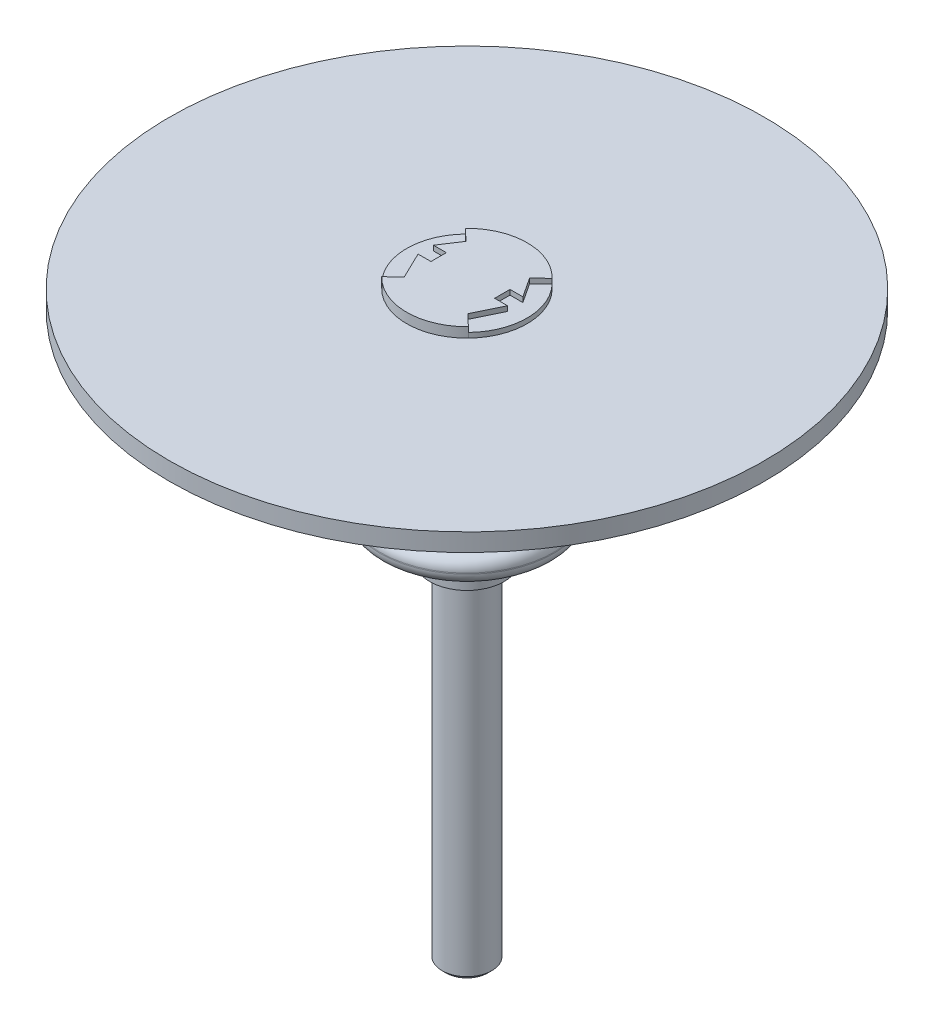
SolidWorks part; units mm, degrees
other "Camera1"
other "Camera2"
ref_plane "Front Plane" through (0, 0, 0) normal (0, 0, 1) x (1, 0, 0)
ref_plane "Top Plane" through (0, 0, 0) normal (0, 1, 0) x (1, 0, 0)
ref_plane "Right Plane" through (0, 0, 0) normal (1, 0, 0) x (0, 0, -1)
sketch "Sketch1" plane through (0, 0, 0) normal (0, 1, 0) x (1, 0, 0)
  circle A0 centre (0, 0) radius 1.5875
  dimension "D1" = 3.175
extrude "Boss-Extrude1" add sketch "Sketch1" along normal blind 22.225
chamfer "Chamfer1" distance 0.254 angle 45 1 edges at (0, 0, 1.5875)
sketch "Sketch2" plane through (0, 22.225, 0) normal (0, 1, 0) x (1, 0, 0)
  circle A0 centre (0, 0) radius 2.3813
  dimension "D1" = 4.7625
extrude "Boss-Extrude2" add sketch "Sketch2" along normal blind 2.3813 separate body
sketch "Sketch3" plane through (0, 24.6062, 0) normal (0, 1, 0) x (1, 0, 0)
  circle A0 centre (0, 0) radius 5.5562
  dimension "D1" = 11.1125
extrude "Boss-Extrude3" add sketch "Sketch3" along normal blind 1.5875 separate body
sketch "Sketch4" plane through (0, 26.1937, 0) normal (0, 1, 0) x (1, 0, 0)
  circle A0 centre (0, 0) radius 4.3656
  dimension "D1" = 8.7312
extrude "Boss-Extrude4" add sketch "Sketch4" along normal blind 9.1281
fillet "Fillet1" radius 0.762 2 edges at (0, 24.6062, 5.5562) (0, 26.1937, 5.5562)
fillet "Fillet2" radius 0.254 1 edges at (0, 26.1937, 4.3656)
chamfer "Chamfer2" distance 0.508 angle 45 1 edges at (0, 35.3219, 4.3656)
sketch "Sketch5" plane through (0, 35.3219, 0) normal (0, 1, 0) x (1, 0, 0)
  circle A0 centre (0, 0) radius 3.8576
extrude "Boss-Extrude5" add sketch "Sketch5" along normal blind 0.7937
sketch "Sketch6" plane through (0, 36.1156, 0) normal (0, 1, 0) x (1, 0, 0)
  circle A0 centre (0, 0) radius 19.05
  dimension "D1" = 38.1
extrude "Boss-Extrude6" add sketch "Sketch6" along normal blind 1.143 separate body
sketch "Sketch7" plane through (0, 37.2586, 0) normal (0, 1, 0) x (1, 0, 0)
  line L0 (-2.7722, 2.6825) -> (-2.0381, 1.9722)
  line L1 (-3.9866, 3.8576) -> (3.9866, 3.8576) construction
  line L2 (-3.9866, 3.8576) -> (-3.9866, -3.8576) construction
  line L3 (-3.9866, -3.8576) -> (3.9866, -3.8576) construction
  line L4 (3.9866, 3.8576) -> (3.9866, -3.8576) construction
  line L5 (-3.9866, 3.8576) -> (3.9866, -3.8576) construction
  line L6 (-3.9866, -3.8576) -> (3.9866, 3.8576) construction
  line L7 (-2.7722, -2.6825) -> (-2.0381, -1.9722)
  line L8 (2.7722, 2.6825) -> (2.0381, 1.9722)
  line L9 (2.7722, -2.6825) -> (2.0381, -1.9722)
  line L10 (-2.0381, 1.9722) -> (-2.0381, -1.9722) construction
  line L11 (-2.0381, 1.9722) -> (-2.8627, 0.7188)
  line L12 (-2.8627, 0.7188) -> (-2.0381, 0.7188)
  line L13 (-2.0381, 0.7188) -> (-2.0381, -0.2653)
  line L14 (-2.0381, -0.2653) -> (-2.8627, -0.2653)
  line L15 (-2.8627, -0.2653) -> (-2.0381, -1.9722)
  line L16 (0, 3.8576) -> (0, -5.2457) construction
  line L17 (2.8627, -0.2653) -> (2.0381, -1.9722)
  line L18 (2.0381, -0.2653) -> (2.8627, -0.2653)
  line L19 (2.0381, 0.7188) -> (2.0381, -0.2653)
  line L20 (2.8627, 0.7188) -> (2.0381, 0.7188)
  line L21 (2.0381, 1.9722) -> (2.8627, 0.7188)
  circle A0 centre (0, 0) radius 3.8576
  circle A1 centre (0, 0) radius 3.8576 construction
extrude "Boss-Extrude7" add sketch "Sketch7" along normal blind 0.3175 separate body contours L0 A0 L7 L15 L14 L13 L12 L11 | L9 A0 L8 L21 L20 L19 L18 L17
sketch "Sketch8" plane through (0, 37.2586, 0) normal (0, 1, 0) x (1, 0, 0)
  line L0 (-2.7722, -2.6825) -> (-2.0381, -1.9722)
  line L1 (-2.7722, -2.6825) -> (-2.0381, -1.9722) construction
  line L2 (-2.0381, -1.9722) -> (-2.8627, -0.2653)
  line L3 (-2.8627, -0.2653) -> (-2.0381, -0.2653)
  line L4 (-2.0381, -0.2653) -> (-2.0381, 0.7188)
  line L5 (-2.0381, 0.7188) -> (-2.8627, 0.7188)
  line L6 (-2.8627, 0.7188) -> (-2.0381, 1.9722)
  line L7 (-2.0381, 1.9722) -> (-2.7722, 2.6825)
  line L8 (0, 0) -> (0, -5.4041) construction
  line L9 (2.0381, 1.9722) -> (2.7722, 2.6825)
  line L10 (2.8627, 0.7188) -> (2.0381, 1.9722)
  line L11 (2.0381, 0.7188) -> (2.8627, 0.7188)
  line L12 (2.0381, -0.2653) -> (2.0381, 0.7188)
  line L13 (2.8627, -0.2653) -> (2.0381, -0.2653)
  line L14 (2.0381, -1.9722) -> (2.8627, -0.2653)
  line L15 (2.7722, -2.6825) -> (2.0381, -1.9722)
  circle A0 centre (0, 0) radius 3.8576 construction
  arc A1 (-2.7722, 2.6825) -> (-2.7722, -2.6825) centre (0, 0) ccw construction
  arc A2 (-2.7722, -2.6825) -> (2.7722, -2.6825) centre (0, 0) ccw
  arc A3 (-2.7722, 2.6825) -> (2.7722, 2.6825) centre (0, 0) cw
extrude "Boss-Extrude8" add sketch "Sketch8" along normal blind 0.635 separate body
sketch "Sketch9" plane through (0, 24.6062, 0) normal (0, -1, 0) x (1, 0, 0)
  circle A0 centre (0, 0) radius 2.3813
  circle A1 centre (0, 0) radius 2.3813 construction
  circle A2 centre (0, 0) radius 4.7943
  circle A3 centre (0, 0) radius 4.7942 construction
extrude "Cut-Extrude1" cut sketch "Sketch9" against normal blind 1.27
